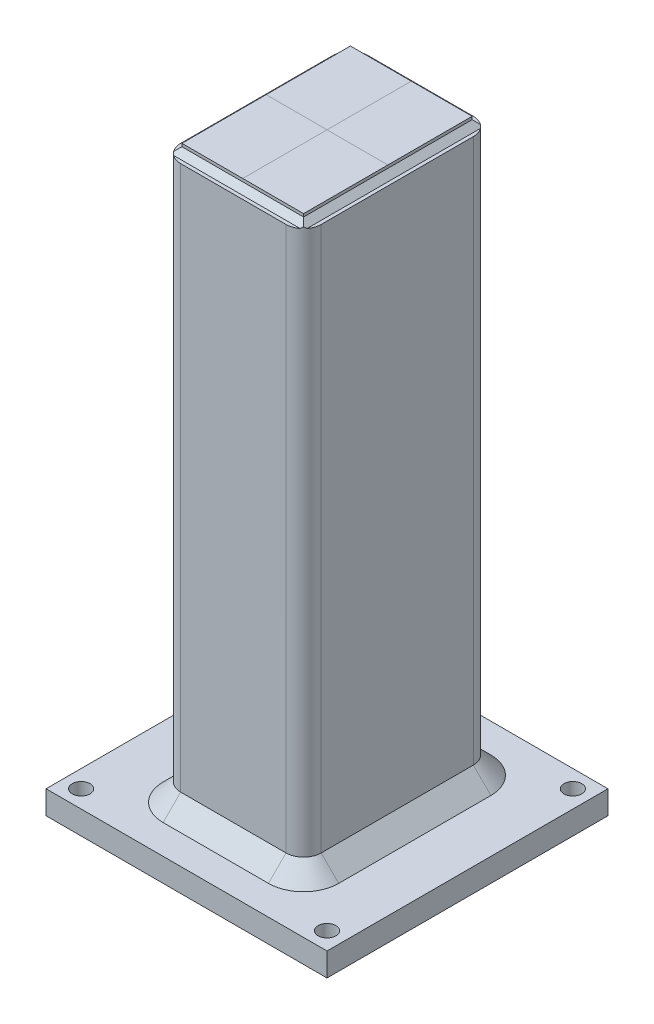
SolidWorks part; units mm, degrees
ref_plane "Front Plane" through (0, 0, 0) normal (0, 0, 1) x (1, 0, 0)
ref_plane "Top Plane" through (0, 0, 0) normal (0, 1, 0) x (1, 0, 0)
ref_plane "Right Plane" through (0, 0, 0) normal (1, 0, 0) x (0, 0, -1)
sketch "Sketch1" plane through (0, 0, 0) normal (0, 1, 0) x (1, 0, 0)
  line L1 (-76.2, 76.2) -> (76.2, 76.2)
  line L2 (-76.2, 76.2) -> (-76.2, -76.2)
  line L3 (-76.2, -76.2) -> (76.2, -76.2)
  line L4 (76.2, 76.2) -> (76.2, -76.2)
  line L5 (-76.2, 76.2) -> (76.2, -76.2) construction
  line L6 (-76.2, -76.2) -> (76.2, 76.2) construction
  point P0 (0, 0)
  dimension "D1" = 152.4
  dimension "D2" = 152.4
extrude "Boss-Extrude1" add sketch "Sketch1" against normal blind 12.7
sketch "Sketch2" plane through (0, 0, 0) normal (0, 1, 0) x (1, 0, 0)
  line L1 (-28.575, 50.8) -> (28.575, 50.8)
  line L2 (-38.1, 41.275) -> (-38.1, -41.275)
  line L3 (-28.575, -50.8) -> (28.575, -50.8)
  line L4 (38.1, 41.275) -> (38.1, -41.275)
  line L5 (-38.1, 50.8) -> (38.1, -50.8) construction
  line L6 (-38.1, -50.8) -> (38.1, 50.8) construction
  line L10 (-31.75, 41.275) -> (-31.75, -41.275)
  line L11 (-28.575, -44.45) -> (28.575, -44.45)
  line L12 (31.75, 41.275) -> (31.75, -41.275)
  line L13 (-28.575, 44.45) -> (28.575, 44.45)
  arc A0 (-38.1, -41.275) -> (-28.575, -50.8) centre (-28.575, -41.275) ccw
  arc A1 (28.575, -50.8) -> (38.1, -41.275) centre (28.575, -41.275) ccw
  arc A2 (28.575, 50.8) -> (38.1, 41.275) centre (28.575, 41.275) cw
  arc A3 (-28.575, 50.8) -> (-38.1, 41.275) centre (-28.575, 41.275) ccw
  arc A4 (-31.75, -41.275) -> (-28.575, -44.45) centre (-28.575, -41.275) ccw
  arc A5 (28.575, -44.45) -> (31.75, -41.275) centre (28.575, -41.275) ccw
  arc A6 (28.575, 44.45) -> (31.75, 41.275) centre (28.575, 41.275) cw
  arc A7 (-28.575, 44.45) -> (-31.75, 41.275) centre (-28.575, 41.275) ccw
  point P0 (0, 0)
  dimension "D4" = 9.525
  dimension "D1" = 76.2
  dimension "D2" = 101.6
  dimension "D3" = 6.35
extrude "Boss-Extrude2" add sketch "Sketch2" along normal blind 304.8
sketch "Sketch3" plane through (0, 304.8, 0) normal (0, 1, 0) x (1, 0, 0)
  line L0 (-28.575, -50.8) -> (28.575, -50.8) construction
  line L1 (-33.02, 45.72) -> (33.02, 45.72)
  line L2 (-33.02, 45.72) -> (-33.02, -45.72)
  line L3 (-33.02, -45.72) -> (33.02, -45.72)
  line L4 (33.02, 45.72) -> (33.02, -45.72)
  line L5 (-33.02, 45.72) -> (33.02, -45.72) construction
  line L6 (-33.02, -45.72) -> (33.02, 45.72) construction
  line L7 (38.1, -41.275) -> (38.1, 41.275) construction
  point P0 (0, 0)
  dimension "D1" = 5.08
  dimension "D2" = 5.08
extrude "Boss-Extrude3" add sketch "Sketch3" along normal blind 4.7625
sketch "Sketch4" plane through (0, 0, 0) normal (0, 1, 0) x (1, 0, 0)
  line L8 (28.575, 49.53) -> (-28.575, 49.53)
  line L9 (-36.83, 41.275) -> (-36.83, -41.275)
  line L10 (-28.575, -49.53) -> (28.575, -49.53)
  line L11 (36.83, -41.275) -> (36.83, 41.275)
  line L12 (28.575, 49.53) -> (-28.575, 49.53)
  line L13 (-36.83, 41.275) -> (-36.83, -41.275)
  line L14 (-28.575, -49.53) -> (28.575, -49.53)
  line L15 (36.83, -41.275) -> (36.83, 41.275)
  arc A8 (36.83, 41.275) -> (28.575, 49.53) centre (28.575, 41.275) ccw
  arc A9 (-28.575, 49.53) -> (-36.83, 41.275) centre (-28.575, 41.275) ccw
  arc A10 (-36.83, -41.275) -> (-28.575, -49.53) centre (-28.575, -41.275) ccw
  arc A11 (28.575, -49.53) -> (36.83, -41.275) centre (28.575, -41.275) ccw
  arc A12 (36.83, 41.275) -> (28.575, 49.53) centre (28.575, 41.275) ccw
  arc A13 (-28.575, 49.53) -> (-36.83, 41.275) centre (-28.575, 41.275) ccw
  arc A14 (-36.83, -41.275) -> (-28.575, -49.53) centre (-28.575, -41.275) ccw
  arc A15 (28.575, -49.53) -> (36.83, -41.275) centre (28.575, -41.275) ccw
  dimension "D1" = 1.27
extrude "Cut-Extrude1" cut sketch "Sketch4" along normal blind 1.27
chamfer "Chamfer1" distance 9.525 angle 45 8 edges at (-38.1, 0, 0) (-35.3102, 0, 48.0102) (-35.3102, 0, -48.0102) (0, 0, 50.8) (0, 0, -50.8) (35.3102, 0, 48.0102) (35.3102, 0, -48.0102) (38.1, 0, 0)
chamfer "Chamfer2" distance 3.175 angle 45 4 edges at (0, 304.8, -45.72) (-33.02, 304.8, 0) (33.02, 304.8, 0) (0, 304.8, 45.72)
sketch "Sketch5" plane through (0, 0, 0) normal (0, 1, 0) x (1, 0, 0)
  line L0 (-76.2, -76.2) -> (76.2, -76.2) construction
  line L1 (-66.675, 66.675) -> (66.675, 66.675) construction
  line L2 (-66.675, 66.675) -> (-66.675, -66.675) construction
  line L3 (-66.675, -66.675) -> (66.675, -66.675) construction
  line L4 (66.675, 66.675) -> (66.675, -66.675) construction
  line L5 (-66.675, 66.675) -> (66.675, -66.675) construction
  line L6 (-66.675, -66.675) -> (66.675, 66.675) construction
  line L7 (76.2, -76.2) -> (76.2, 76.2) construction
  circle A0 centre (66.675, 66.675) radius 4.826
  circle A1 centre (66.675, -66.675) radius 4.826
  circle A2 centre (-66.675, -66.675) radius 4.826
  circle A3 centre (-66.675, 66.675) radius 4.826
  point P0 (0, 0)
  dimension "D3" = 9.652
  dimension "D1" = 9.525
  dimension "D2" = 9.525
extrude "Cut-Extrude2" cut sketch "Sketch5" against normal through all
sketch "Sketch6" plane through (0, -12.7, 0) normal (0, -1, 0) x (1, 0, 0)
  line L1 (-152.4, -152.4) -> (152.4, -152.4)
  line L2 (-152.4, -152.4) -> (-152.4, 152.4)
  line L3 (-152.4, 152.4) -> (152.4, 152.4)
  line L4 (152.4, -152.4) -> (152.4, 152.4)
  line L5 (-152.4, -152.4) -> (152.4, 152.4) construction
  line L6 (-152.4, 152.4) -> (152.4, -152.4) construction
  point P0 (0, 0)
  dimension "D1" = 304.8
  dimension "D2" = 304.8
extrude "Boss-Extrude4" [suppressed] add sketch "Sketch6" along normal blind 25.4 separate body
sketch "Sketch7" [suppressed] plane through (0, -12.7, 0) normal (0, 1, 0) x (1, 0, 0)
  circle A0 centre (-66.675, -66.675) radius 4.826 construction
  circle A1 centre (-66.675, 66.675) radius 4.826 construction
  circle A2 centre (66.675, 66.675) radius 4.826 construction
  circle A3 centre (66.675, -66.675) radius 4.826 construction
  circle A4 centre (-66.675, -66.675) radius 4.826
  circle A5 centre (-66.675, 66.675) radius 4.826
  circle A6 centre (66.675, 66.675) radius 4.826
  circle A7 centre (66.675, -66.675) radius 4.826
extrude "Cut-Extrude3" [suppressed] cut sketch "Sketch7" against normal through all
ref_plane "Plane1" through (0, -12.7, 0) normal (0, -1, 0) x (-1, 0, 0)
sketch "Sketch8" plane through (0, 309.5625, 0) normal (0, 1, 0) x (1, 0, 0)
  line L0 (-33.02, 0) -> (33.02, 0)
  line L1 (-33.02, 45.72) -> (-33.02, -45.72) construction
  line L2 (33.02, -45.72) -> (33.02, 45.72) construction
  line L3 (0, 45.72) -> (0, -45.72)
  line L4 (33.02, 45.72) -> (-33.02, 45.72) construction
  line L5 (-33.02, -45.72) -> (33.02, -45.72) construction
